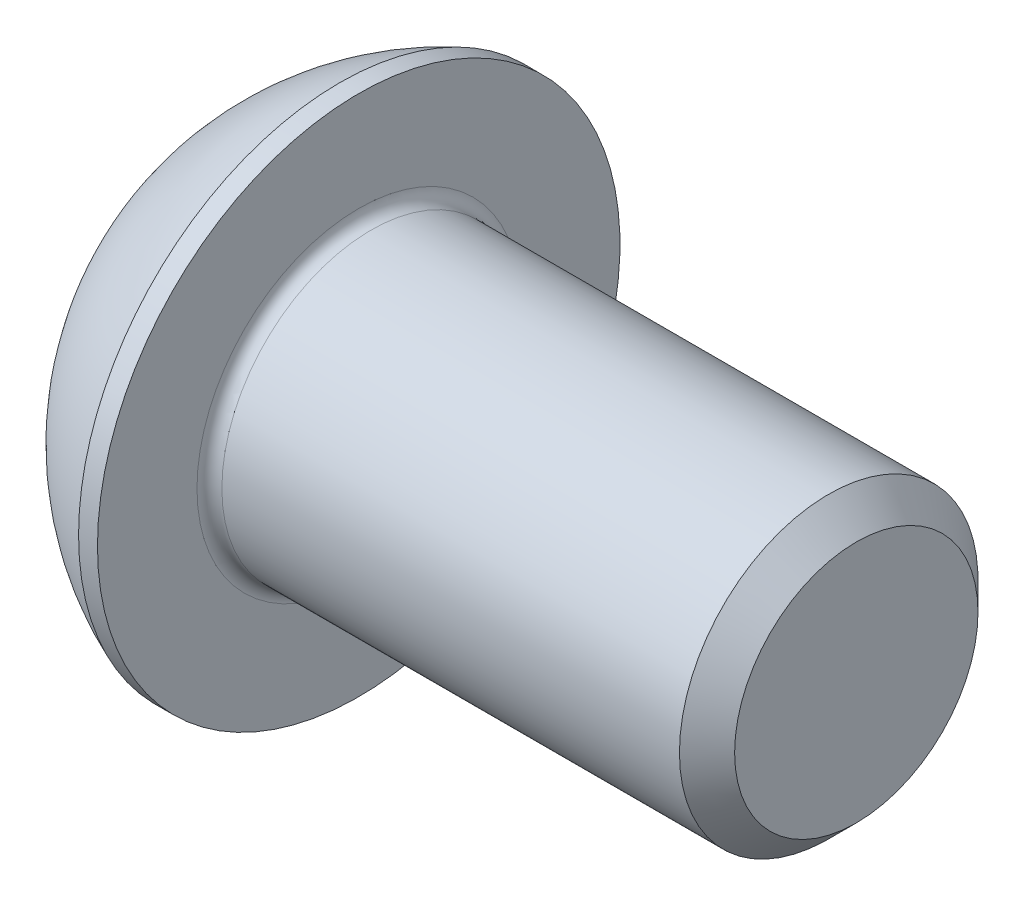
SolidWorks part; units mm, degrees
ref_plane "Plane1" through (0, 0, 0) normal (0, 0, 1) x (1, 0, 0)
ref_plane "Plane2" through (0, 0, 0) normal (0, 1, 0) x (1, 0, 0)
ref_plane "Plane3" through (0, 0, 0) normal (1, 0, 0) x (0, 0, -1)
sketch "BodySke" plane through (0, 0, 0) normal (0, 0, 1) x (1, 0, 0)
  line L0 (13.3, 0) -> (13.3, 2.4455)
  line L1 (12.7455, 3) -> (3.3, 3)
  line L2 (3.3, 3) -> (3.3, 5.25)
  line L3 (3.3, 5.25) -> (2.92, 5.25)
  line L4 (0, 0) -> (101.6, 0) construction
  line L5 (3.3, -5.25) -> (2.92, -5.25) construction
  line L6 (55.6768, -3) -> (3.3, -3) construction
  line L7 (13.3, 0) -> (0, 0)
  line L8 (0, 2.625) -> (0, -2.625) construction
  line L9 (0, 0) -> (0, 2.625)
  line L10 (13.3, 2.4455) -> (12.7455, 3)
  line L11 (13.3, -2.4455) -> (12.7455, -3) construction
  line L12 (4.3, 9.525) -> (4.3, -3) construction
  line L13 (3.3, 9.525) -> (3.3, -3) construction
  arc A1 (0, 2.625) -> (2.92, 5.25) centre (4.9997, 0) cw
revolve "BaseBody" add sketch "BodySke" angle 360 about L4
fillet "Fillet1" radius 0.25 1 edges at (3.3, 0, 3)
sketch "Sketch2" plane through (0, 0, 0) normal (0, 0, 1) x (1, 0, 0)
  line L0 (0, 2) -> (2.08, 2)
  line L1 (2.08, 2) -> (3.2347, 0)
  line L3 (3.2347, 0) -> (0, 0)
  line L4 (0, 0) -> (0, 2)
  line L5 (0, -2) -> (2.08, -2) construction
  line L6 (0, 0) -> (47.625, 0) construction
  dimension "D2" = 60
  dimension "PreBroach_depth" = 2.08
  dimension "PreBroach_dia" = 4
revolve "PreBroach" cut sketch "Sketch2" angle 360 about L6
sketch "Sketch3" plane through (0, 0, 0) normal (1, 0, 0) x (0, 0, -1)
  line L0 (-2, -1.1547) -> (-2, 1.1547)
  line L1 (-2, 1.1547) -> (0, 2.3094)
  line L2 (0, 2.3094) -> (2, 1.1547)
  line L3 (2, 1.1547) -> (2, -1.1547)
  line L4 (2, -1.1547) -> (0, -2.3094)
  line L5 (0, -2.3094) -> (-2, -1.1547)
extrude "Hex" cut sketch "Sketch3" along normal blind 2.08
sketch "ThdSchSke" plane through (0, 0, 0) normal (0, 0, 1) x (1, 0, 0)
  line L0 (5.3, -2.4455) -> (4.9117, -3)
  line L1 (5.3, -2.4455) -> (5.6883, -3)
  line L2 (5.6883, -3) -> (5.6883, -3.75)
  line L3 (-3.175, 0) -> (5.1513, 0) construction
  line L5 (5.6883, -3.75) -> (4.9117, -3.75)
  line L6 (4.9117, -3.75) -> (4.9117, -3)
revolve "ThreadSchematic" [suppressed] cut sketch "ThdSchSke" angle 360 about L3
pattern_linear "ThdSchPat" [suppressed]
thread "Filetage1" pitch 1 start angle 0, offset 2, length 10, pitch 1, diameter 6
ref_plane "Plan1" through (14.7455, 0, 3) normal (0, -1, 0) x (0, 0, 1)
sketch "Profil de filetage1" plane through (14.7455, 0, 3) normal (0, -1, 0) x (0, 0, 1)
  line L0 (0, 0) -> (0, 1) construction
  line L11 (0, 0) -> (0, 0.875)
  line L12 (0, 0.875) -> (-0.5413, 0.5625)
  line L13 (-0.5413, 0.5625) -> (-0.5413, 0.3125)
  line L15 (-0.5413, 0.3125) -> (0, 0)
  line L17 (-0.5413, 0.4375) -> (0, 0.4375) construction
  point P2 (0, 0)
  dimension "Pitch" = 1
  dimension "Profile_Angle" = 60
  dimension "Profile_Land" = 0.25
  dimension "Profile_Height" = 0.5413
equation "\"D1@BodySke\" = \"Head_dia@BodySke\" * .5"
equation "\"D1@Sketch3\" = \"Hex_size@Sketch3\" / 2"
equation "\"D2@Sketch3\" = \"D1@Sketch3\""
equation "\"D3@Sketch3\" = \"Hex_size@Sketch3\""
equation "\"Thread_minor@ThdSchSke\" = \"Minor_dia@BodySke\""
equation "\"Diameter@ThdSchSke\" = \"Diameter@BodySke\""
equation "\"Overcut@ThdSchSke\" = \"Diameter@BodySke\" * 1.25"
